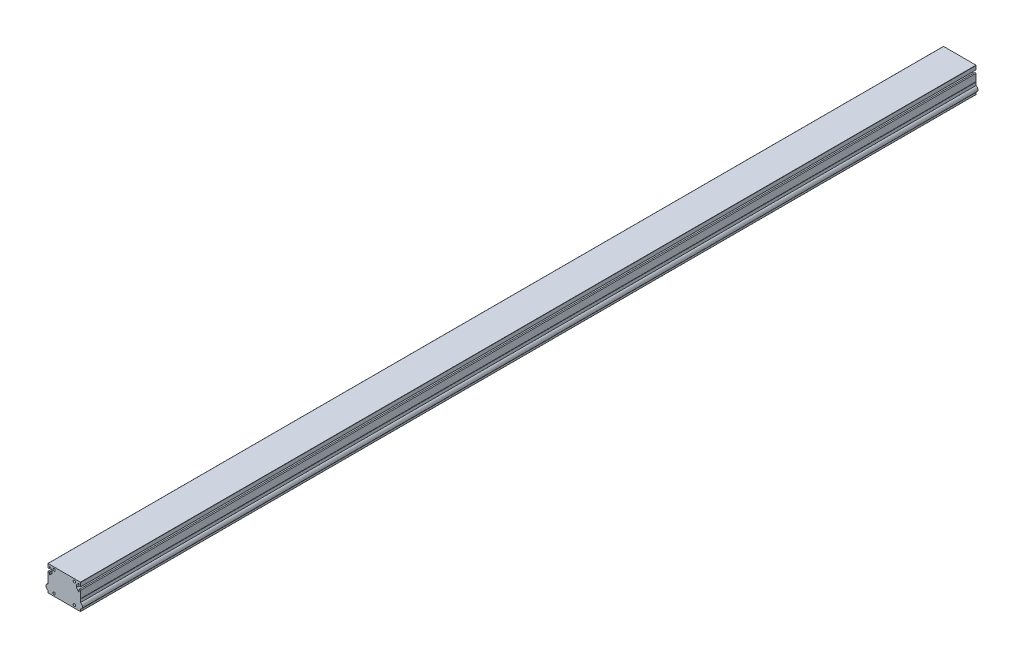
SolidWorks part; units mm, degrees
ref_plane "Ebene vorne" through (0, 0, 0) normal (0, 0, 1) x (1, 0, 0)
ref_plane "Ebene oben" through (0, 0, 0) normal (0, 1, 0) x (1, 0, 0)
ref_plane "Ebene rechts" through (0, 0, 0) normal (1, 0, 0) x (0, 0, -1)
sketch "Skizze1" plane through (0, 0, 0) normal (0, 0, 1) x (1, 0, 0)
  line L0 (0, -28.3625) -> (0, 25.1272) construction
  line L1 (-45, 35) -> (45, 35)
  line L2 (-45, 35) -> (-45, -35)
  line L3 (-45, -35) -> (45, -35)
  line L4 (45, 35) -> (45, -35)
  line L5 (-16.392, 0) -> (38.3918, 0) construction
  dimension "D1" = 70
  dimension "D2" = 90
  dimension "D3" = 45
  dimension "D4" = 35
extrude "Linear austragen1" add sketch "Skizze1" along normal blind 2460
sketch "Skizze5" plane through (0, 0, 0) normal (0, 0, -1) x (-1, 0, 0)
  line L0 (45, 35) -> (45, -35) construction
  line L1 (45, 24.05) -> (45, 15.95)
  line L2 (45, 24.05) -> (41.5, 24.05)
  line L3 (41, 24.55) -> (41, 30)
  line L4 (40.1464, 30.3536) -> (33.2, 23.4071)
  line L5 (15.296, 20) -> (21.4231, 20) construction
  line L6 (-45, 35) -> (45, 35) construction
  line L7 (45, 15.95) -> (41.5, 15.95)
  line L8 (41, 15.45) -> (41, 10)
  line L9 (40.1464, 9.6464) -> (33.2, 16.5929)
  line L10 (33.2, 23.4071) -> (33.2, 16.5929)
  arc A0 (40.1464, 30.3536) -> (41, 30) centre (40.5, 30) cw
  arc A1 (41.5, 24.05) -> (41, 24.55) centre (41.5, 24.55) cw
  arc A2 (41.5, 15.95) -> (41, 15.45) centre (41.5, 15.45) ccw
  arc A3 (40.1464, 9.6464) -> (41, 10) centre (40.5, 10) ccw
  point P14 (41, 24.05)
  dimension "D6" = 0.5
  dimension "D1" = 4
  dimension "D2" = 4.05
  dimension "D3" = 15
  dimension "D4" = 45
  dimension "D5" = 11.8
  dimension "D7" = 10.5
extrude "Schnitt-Linear austragen4" cut sketch "Skizze5" against normal through all
sketch "Skizze4" plane through (0, 0, 0) normal (0, 0, -1) x (-1, 0, 0)
  line L0 (45, 35) -> (45, 24.05) construction
  line L1 (45, -35) -> (-45, -35) construction
  line L2 (42, -21) -> (15.2489, 5.7511) construction
  line L3 (45, -13.5299) -> (45, -28.4701)
  arc A0 (45, -13.5299) -> (45, -28.4701) centre (42, -21) ccw
  dimension "D1" = 16.1
  dimension "D2" = 3
  dimension "D3" = 14
  dimension "D4" = 45
extrude "Schnitt-Linear austragen3" cut sketch "Skizze4" against normal through all
sketch "Skizze8" plane through (0, 0, 0) normal (0, 0, -1) x (-1, 0, 0)
  line L0 (45, 15.95) -> (45, -13.5299) construction
  line L3 (45, -3.8) -> (45, -5)
  line L4 (17.5007, -4.4) -> (34.0595, -4.4) construction
  line L5 (45, -35) -> (-45, -35) construction
  arc A0 (45, -3.8) -> (45, -5) centre (45, -4.4) ccw
  dimension "D2" = 0.6
  dimension "D1" = 0.6
  dimension "D4" = 30.6
extrude "Schnitt-Linear austragen5" cut sketch "Skizze8" against normal through all
hole_wizard "Ø6.7 (6.7) Durchmesser Bohrung1" positions "Skizze7" profile "Skizze6" hole size "Ø6.7" standard "DIN"
sketch "Skizze7" plane through (0, 0, 0) normal (0, 0, -1) x (-1, 0, 0)
  point P1 (28, -28)
  point P3 (28, 28)
sketch "Skizze6" plane through (-28, -28, 0) normal (1, 0, 0) x (0, 1, 0)
  line L0 (0, 0) -> (0, 2460)
  line L1 (0, 2460) -> (3.35, 2460)
  line L2 (3.35, 2460) -> (3.35, 0)
  line L5 (3.35, 0) -> (0, 0)
  line L11 (0, -6.35) -> (0, 107.95) construction
  dimension "Bohrerdurchmesser" = 6.7
  dimension "Bohrungstiefe" = 2460
mirror "Spiegeln1" about plane through (0, 0, 0) normal (1, 0, 0) of "Schnitt-Linear austragen5", "Ø6.7 (6.7) Durchmesser Bohrung1", "Schnitt-Linear austragen4", "Schnitt-Linear austragen3"
fillet "Verrundung1" radius 0.3 4 edges at (-45, -28.4701, 1230) (-45, -13.5299, 1230) (45, -13.5299, 1230) (45, -28.4701, 1230)
fillet "Verrundung2" radius 0.5 4 edges at (45, 35, 1230) (45, -35, 1230) (-45, -35, 1230) (-45, 35, 1230)
sketch "Skizze9" plane through (0, 0, 0) normal (0, 0, -1) x (-1, 0, 0)
  circle A0 centre (-42, -21) radius 8.05
  circle A1 centre (42, -21) radius 8.05
  dimension "D1" = 16.1
  dimension "D2" = 16.1
extrude "Linear austragen2" add sketch "Skizze9" against normal up to surface (2460 mm away)
